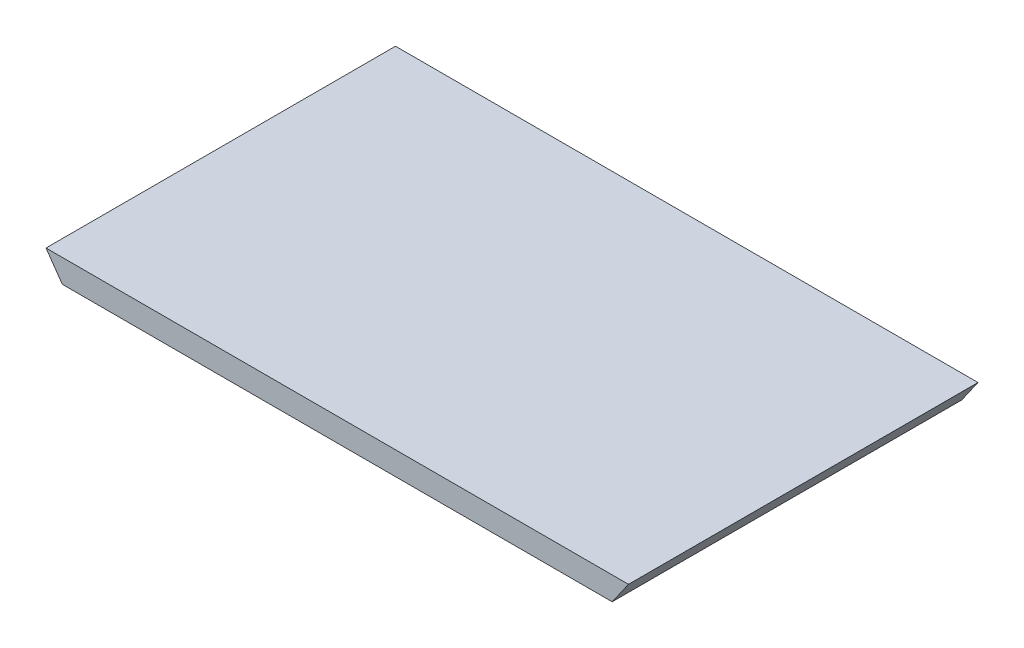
SolidWorks part; units mm, degrees
ref_plane "Plan de face" through (0, 0, 0) normal (0, 0, 1) x (1, 0, 0)
ref_plane "Plan de dessus" through (0, 0, 0) normal (0, 1, 0) x (1, 0, 0)
ref_plane "Plan de droite" through (0, 0, 0) normal (1, 0, 0) x (0, 0, -1)
sketch "Esquisse1" plane through (0, 0, 0) normal (0, 1, 0) x (1, 0, 0)
  line L1 (-250, -150) -> (250, -150)
  line L2 (-250, -150) -> (-250, 150)
  line L3 (-250, 150) -> (250, 150)
  line L4 (250, -150) -> (250, 150)
  line L5 (-250, -150) -> (250, 150) construction
  line L6 (-250, 150) -> (250, -150) construction
  point P0 (0, 0)
  dimension "D1" = 300
  dimension "D2" = 500
extrude "Boss.-Extru.1" add sketch "Esquisse1" along normal mid plane 20
sketch "Esquisse2" plane through (0, 0, 150) normal (0, 0, 1) x (1, 0, 0)
  line L0 (250, 10) -> (235.9958, -10)
  line L1 (-250, -10) -> (250, -10) construction
  line L2 (235.9958, -10) -> (250, -10)
  line L3 (250, -10) -> (250, 10)
  line L4 (-250, 10) -> (-235.9958, -10)
  line L5 (-235.9958, -10) -> (-250, -10)
  line L6 (-250, -10) -> (-250, 10)
  dimension "D1" = 35
  dimension "D2" = 35
extrude "Enlèv. mat.-Extru.1" cut sketch "Esquisse2" against normal up to next
equation "\"D1@Esquisse2\"=\"D2@Esquisse2\""
